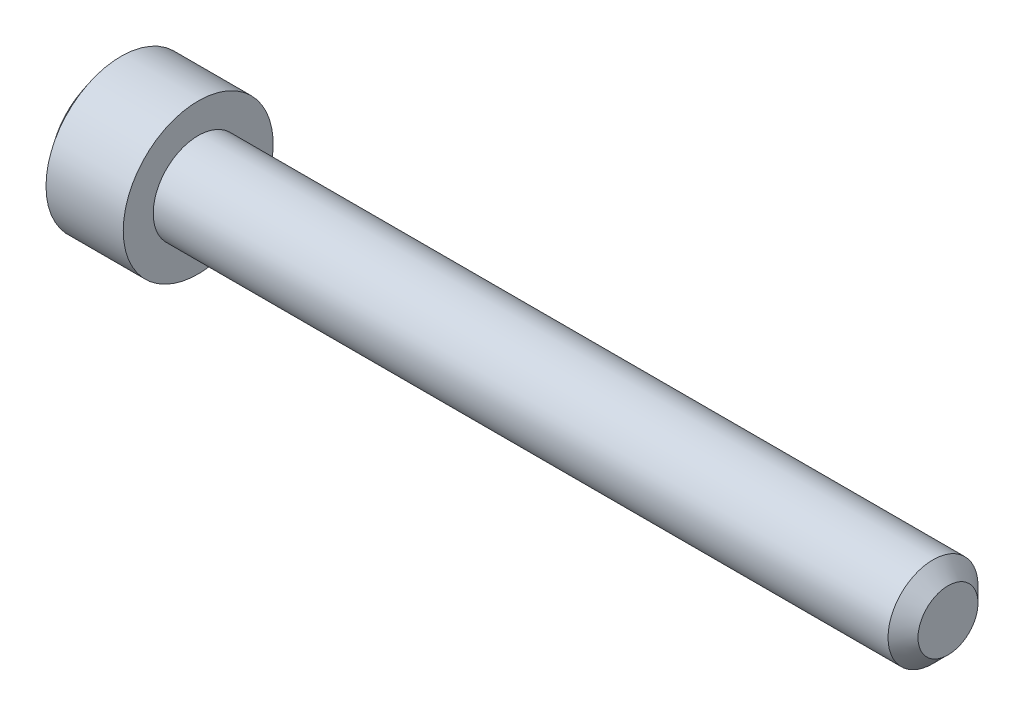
SolidWorks part; units mm, degrees
ref_plane "Plan1" through (0, 0, 0) normal (0, 0, 1) x (1, 0, 0)
ref_plane "Plan2" through (0, 0, 0) normal (0, 1, 0) x (1, 0, 0)
ref_plane "Plan3" through (0, 0, 0) normal (1, 0, 0) x (0, 0, -1)
sketch "Esquisse1" plane through (0, 0, 0) normal (0, 0, 1) x (1, 0, 0)
  line L0 (-28.5762, 0) -> (32.6169, 0) construction
  line L1 (0, 0) -> (0, 3.8686)
  line L2 (0, 3.8686) -> (0.8485, 5)
  line L3 (0.8485, 5) -> (6, 5)
  line L4 (6, 5) -> (6, 3)
  line L5 (6, 3) -> (55, 3)
  line L6 (55, 3) -> (56, 2)
  line L7 (56, 2) -> (56, 0)
  line L8 (56, 0) -> (0, 0)
  dimension "D1" = 1
  dimension "D2" = 1
  dimension "D3" = 6
  dimension "D4" = 50
  dimension "D5" = 5
revolve "Base-Révolution" add sketch "Esquisse1" angle 360 about L0
sketch "Esquisse2" plane through (0, 5.4655, -1.3914) normal (-1, 0, 0) x (0, 0, 1)
  line L4 (-0.5046, -7.6591) -> (-1.508, -5.4655)
  line L5 (2.8032, -7.998) -> (-0.5046, -7.6591)
  line L8 (4.2909, -5.4655) -> (2.8032, -7.998)
  line L9 (-1.508, -5.4655) -> (-0.0203, -2.9329)
  line L11 (-0.0203, -2.9329) -> (3.2874, -3.2718)
  line L13 (3.2874, -3.2718) -> (4.2909, -5.4655)
  dimension "D1" = 5
  dimension "D2" = 4.7509
  dimension "D3" = 5.2734
extrude "Enlèv. mat.-Extru.1" cut sketch "Esquisse2" against normal blind 3
